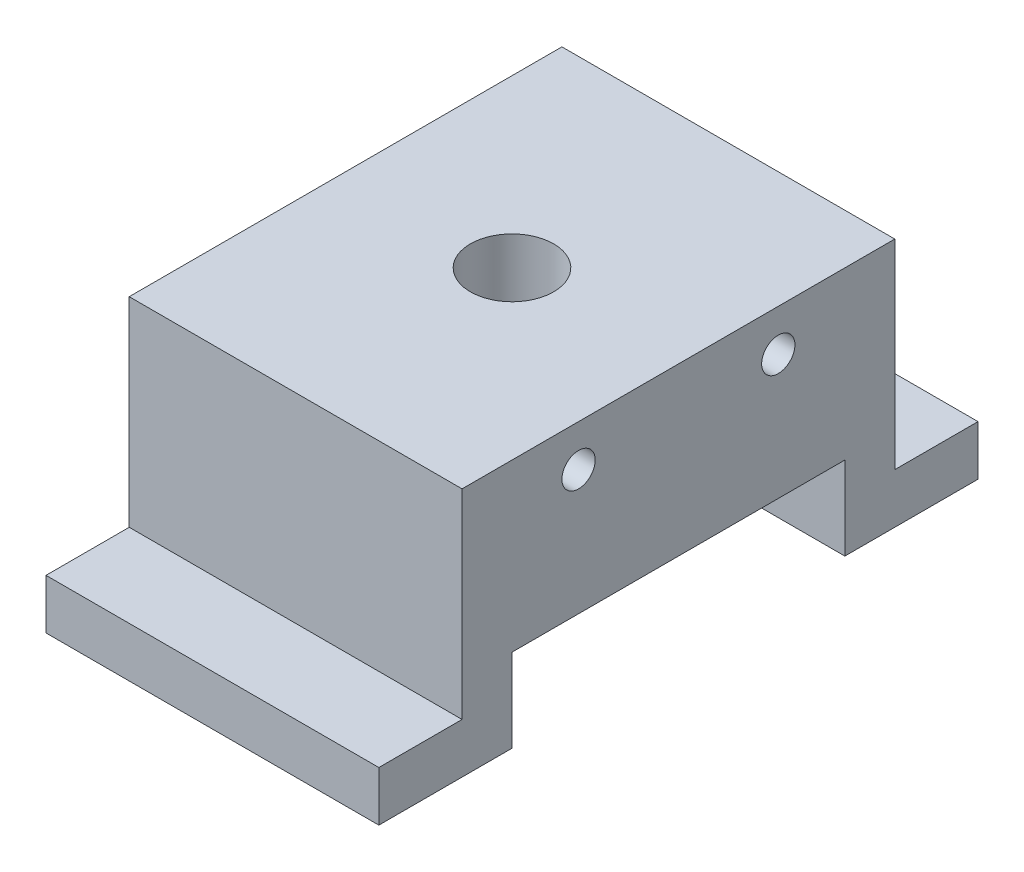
SolidWorks part; units mm, degrees
ref_plane "Front Plane" through (0, 0, 0) normal (0, 0, 1) x (1, 0, 0)
ref_plane "Top Plane" through (0, 0, 0) normal (0, 1, 0) x (1, 0, 0)
ref_plane "Right Plane" through (0, 0, 0) normal (1, 0, 0) x (0, 0, -1)
sketch "Sketch1" plane through (0, 0, 0) normal (1, 0, 0) x (0, 0, -1)
  line L8 (-10, 0) -> (-18, 0)
  line L9 (-18, 0) -> (-18, 3)
  line L10 (-18, 3) -> (-13, 3)
  line L11 (-13, 3) -> (-13, 15)
  line L12 (-13, 15) -> (13, 15)
  line L14 (10, 5) -> (-10, 5)
  line L15 (-10, 5) -> (-10, 0)
  line L16 (0, 0) -> (0, 15) construction
  line L17 (10, 5) -> (10, 0)
  line L18 (13, 3) -> (13, 15)
  line L19 (18, 3) -> (13, 3)
  line L20 (18, 0) -> (18, 3)
  line L21 (10, 0) -> (18, 0)
  line L22 (-13, 12.5) -> (13, 12.5) construction
  circle A0 centre (-6, 12.5) radius 1
  circle A1 centre (6, 12.5) radius 1
  point P14 (0, 5)
  dimension "D8" = 2
  dimension "D9" = 2
  dimension "D10" = 6
  dimension "D11" = 6
  dimension "D1" = 5
  dimension "D2" = 15
  dimension "D3" = 3
  dimension "D4" = 3
  dimension "D5" = 8
  dimension "D6" = 10
  dimension "D7" = 2.5
extrude "Boss-Extrude1" add sketch "Sketch1" along normal mid plane 20
sketch "Sketch2" plane through (0, 5, 0) normal (0, -1, 0) x (1, 0, 0)
  line L0 (-10, 10) -> (10, -10) construction
  line L1 (10, -10) -> (10, -18) construction
  line L2 (10, -10) -> (-10, -10) construction
  line L3 (10, 10) -> (-10, -10) construction
  circle A0 centre (0, 0) radius 7
  dimension "D1" = 14
extrude "Cut-Extrude1" cut sketch "Sketch2" against normal blind 5
sketch "Sketch3" plane through (0, 10, 0) normal (0, -1, 0) x (1, 0, 0)
  circle A0 centre (0, 0) radius 2.5
  dimension "D1" = 5
extrude "Cut-Extrude2" cut sketch "Sketch3" against normal through all
